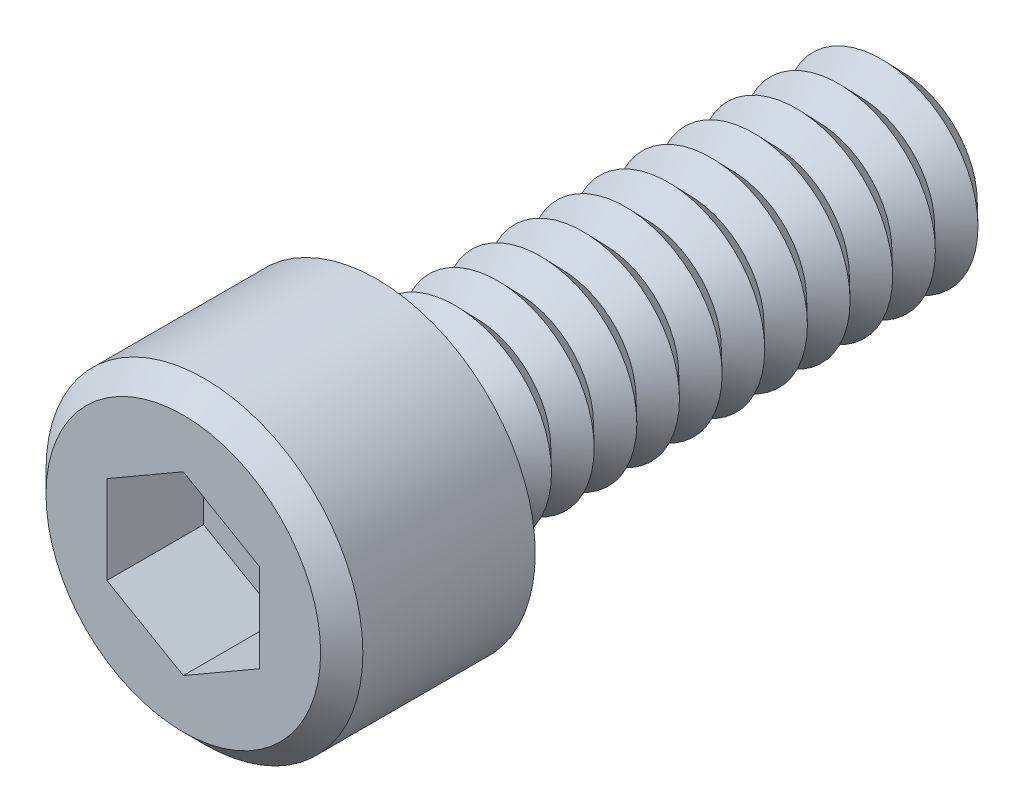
SolidWorks part; units mm, degrees
ref_plane "Plane1" through (0, 0, 0) normal (0, 0, 1) x (1, 0, 0)
ref_plane "Plane2" through (0, 0, 0) normal (0, 1, 0) x (1, 0, 0)
ref_plane "Plane3" through (0, 0, 0) normal (1, 0, 0) x (0, 0, -1)
sketch "Sketch1" plane through (0, 0, 0) normal (0, 0, 1) x (1, 0, 0)
  circle A0 centre (0, 0) radius 1.7526
extrude "Shank" add sketch "Sketch1" along normal blind 9.525
sketch "Sketch2" plane through (0, 0, 9.525) normal (0, 0, 1) x (1, 0, 0)
  circle A0 centre (0, 0) radius 2.8702
  dimension "CapDia" = 5.7404
extrude "Cap" add sketch "Sketch2" along normal blind 3.5052
fillet "Fillet1" radius 0.254 1 edges at (1.7526, 0, 9.525)
sketch "Sketch3" plane through (4.8749, 0.9257, 13.0302) normal (0, 0, 1) x (1, 0, 0)
  line L0 (-6.2592, -0.1265) -> (-3.4906, -0.1265) construction
  line L1 (-6.2592, -0.1265) -> (-6.2592, -1.7249) construction
  line L2 (-3.4906, -1.7249) -> (-6.2592, -1.7249) construction
  line L3 (-3.4906, -1.7249) -> (-3.4906, -0.1265) construction
  line L4 (-4.8749, 0.6728) -> (-3.4906, -0.1265)
  line L5 (-3.4906, -0.1265) -> (-3.4906, -1.7249)
  line L6 (-4.8749, -99.8608) -> (-4.8749, 84.0399) construction
  line L7 (-90.4234, -0.9257) -> (85.1888, -0.9257) construction
  line L8 (-6.2592, -0.1265) -> (-6.2592, -1.7249)
  line L9 (-4.8749, 0.6728) -> (-6.2592, -0.1265)
  line L10 (-4.8749, -2.5241) -> (-3.4906, -1.7249)
  line L11 (-4.8749, -2.5241) -> (-6.2592, -1.7249)
  circle A0 centre (-4.8749, -0.9257) radius 1.5985 construction
  point P14 (-3.4906, -0.9257)
  point P15 (-6.2592, -0.9257)
extrude "HexCut" cut sketch "Sketch3" against normal blind 1.7526
chamfer "Chamfer1" distance 0.3827 angle 45 1 edges at (2.8702, 0, 13.0302)
sketch "Sketch4" plane through (0, 0, 0) normal (1, 0, 0) x (0, 0, -1)
  line L0 (27.0106, 0) -> (-16.4041, 0) construction
  line L1 (-9.271, 0) -> (0, 0) construction
  line L2 (25.3635, 1.3525) -> (-14.9923, 1.3525) construction
  line L3 (0, 1.3525) -> (0, 1.7526)
  line L4 (0, 1.7526) -> (-9.271, 1.7526) construction
  line L5 (0, 1.7526) -> (-0.3863, 1.7526)
  line L6 (-0.3863, 1.7526) -> (0, 1.3525)
  dimension "MinorDia" = 2.7051
  dimension "ThreadWidth" = 0.3863
revolve "Thread1" cut sketch "Sketch4" angle 360 about L0
sketch "Sketch5" plane through (0, 0, 0) normal (1, 0, 0) x (0, 0, -1)
  line L0 (-0.3863, 38.4691) -> (-0.3863, 8.5846) construction
  line L1 (-0.3863, 1.7526) -> (-0.3863, -1.7526) construction
  line L2 (-0.3863, 1.7526) -> (-0.7726, 1.3525)
  line L3 (0, 1.3525) -> (0, 1.7526)
  line L4 (0, 1.7526) -> (-0.3863, 1.7526)
  line L5 (-0.3863, 1.7526) -> (0, 1.3525)
  line L6 (0, 1.3525) -> (0, 1.7526) construction
  line L7 (0, 1.7526) -> (-0.7726, 1.7526) construction
  line L8 (-0.3863, 1.7526) -> (0, 1.3525) construction
  line L9 (-0.7726, 1.3525) -> (-0.7726, 1.7526)
  line L10 (-0.7726, 1.7526) -> (-0.3863, 1.7526)
  line L11 (-13.6981, 0) -> (27.2459, 0) construction
  line L12 (-9.271, 0) -> (-0.3863, 0) construction
  point P9 (-0.3863, 1.7526)
  dimension "D1" = 0
revolve "Thread2" cut sketch "Sketch5" angle 360 about L11
pattern_linear "Threads" count 12 spacing 0.7726 along (0, 0, 1) of "Thread1", "Thread2"
equation "\"HexDepth@HexCut\" = .5 * \"ThreadDia@Cap\""
equation "\"Cut@Chamfer1\" =  ( 1 / 15 )  * \"CapDia@Sketch2\""
equation "\"ThreadWidth@Threads\" =\"ThreadWidth@Sketch4\"  * 2"
